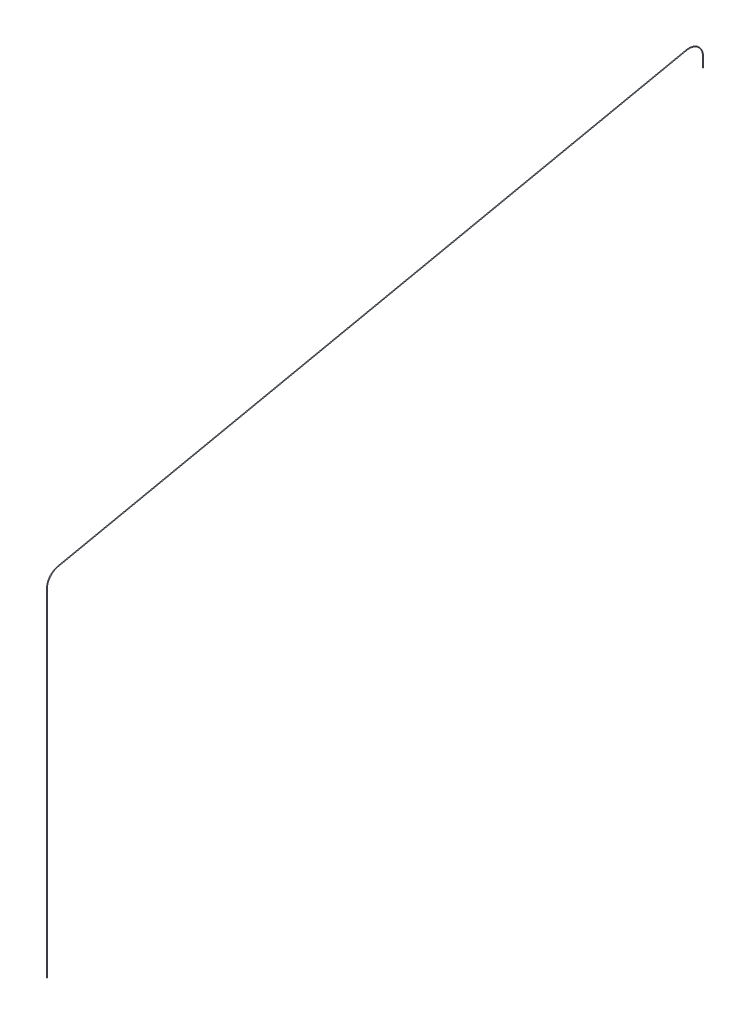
SolidWorks part; units mm, degrees
ref_plane "Front Plane" through (0, 0, 0) normal (0, 0, 1) x (1, 0, 0)
ref_plane "Top Plane" through (0, 0, 0) normal (0, 1, 0) x (1, 0, 0)
ref_plane "Right Plane" through (0, 0, 0) normal (1, 0, 0) x (0, 0, -1)
sketch "Sketch2" plane through (0, 0, 0) normal (1, 0, 0) x (0, 0, -1)
  line L0 (18546.3863, 4345.1308) -> (-86.0618, 407.2049)
  line L1 (-416.2, 0) -> (-416.2, -10000)
  line L2 (19047.2, 3939.1) -> (19047.2, 3645.1215)
  arc A0 (-86.0618, 407.2049) -> (-416.2, 0) centre (0, 0) ccw
  arc A1 (19047.2, 3939.1) -> (18546.3863, 4345.1308) centre (18632.2, 3939.1) ccw
  dimension "D1" = 832.4
  dimension "D2" = 830
  dimension "D3" = 3939.1
  dimension "D4" = 18632.2
  dimension "D5" = 10000
ref_plane "Plane1" through (0, -10000, 0) normal (0, 1, 0) x (1, 0, 0)
sketch "Sketch3" plane through (0, -10000, 0) normal (0, 1, 0) x (1, 0, 0)
  circle A0 centre (0, -416.2) radius 9.5
  dimension "D1" = 19
sweep "Sweep1" add profiles "Sketch3" path "Sketch2"
